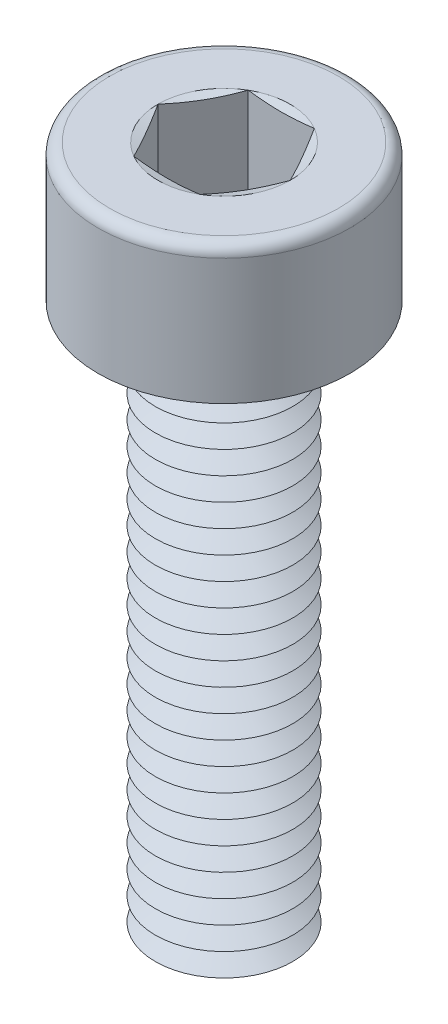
SolidWorks part; units mm, degrees
ref_plane "Front Plane" through (0, 0, 0) normal (0, 0, 1) x (1, 0, 0)
ref_plane "Top Plane" through (0, 0, 0) normal (0, 1, 0) x (1, 0, 0)
ref_plane "Right Plane" through (0, 0, 0) normal (1, 0, 0) x (0, 0, -1)
sketch "Sketch1" plane through (0, 0, 0) normal (0, 1, 0) x (1, 0, 0)
  circle A0 centre (0, 0) radius 1.5
  dimension "D1" = 3
extrude "Extrude1" add sketch "Sketch1" along normal blind 12
sketch "Sketch2" plane through (0, 12, 0) normal (0, 1, 0) x (1, 0, 0)
  circle A0 centre (0, 0) radius 2.75
  dimension "D1" = 5.5
extrude "Extrude2" add sketch "Sketch2" along normal blind 3
sketch "Sketch3" plane through (0, 15, 0) normal (0, 1, 0) x (1, 0, 0)
  line L1 (0.7217, 1.25) -> (-0.7217, 1.25)
  line L2 (-0.7217, 1.25) -> (-1.4434, 0)
  line L3 (-1.4434, 0) -> (-0.7217, -1.25)
  line L4 (-0.7217, -1.25) -> (0.7217, -1.25)
  line L5 (0.7217, -1.25) -> (1.4434, 0)
  line L6 (1.4434, 0) -> (0.7217, 1.25)
  circle A0 centre (0, 0) radius 1.25 construction
  dimension "D1" = 2.5
extrude "Extrude3" cut sketch "Sketch3" against normal blind 2.5
fillet "Fillet1" radius 0.25 1 edges at (0, 15, 2.75)
sketch "Sketch4" plane through (0, 0, 0) normal (1, 0, 0) x (0, 0, -1)
  line L0 (-1.25, 12.5) -> (0, 12.5)
  line L1 (0, 12.5) -> (0, 11.7783)
  line L2 (0, 11.7783) -> (-1.25, 12.5)
  dimension "D1" = 30
revolve "Cut-Revolve1" cut sketch "Sketch4" angle 360 about L1
sketch "Sketch5" plane through (0, 0, 0) normal (0, 0, 1) x (1, 0, 0)
  line L0 (-1.5, 0.25) -> (-1.5, -0.25)
  line L1 (-1.5, 12) -> (-1.5, 0) construction
  line L2 (-1.5, -0.25) -> (-1.067, 0)
  line L3 (-1.5, 0) -> (1.5, 0) construction
  line L4 (-1.067, 0) -> (-1.5, 0.25)
  dimension "D1" = 0.5
revolve "Cut-Revolve2" cut sketch "Sketch5" angle 360 about axis through (0, 12, 0) along (0, -1, 0)
pattern_linear "LPattern1" count 24 spacing 0.5 along (0, 1, 0) of "Cut-Revolve2"
sketch "Sketch6" plane through (0, 15, 0) normal (0, 1, 0) x (1, 0, 0)
  circle A0 centre (0, 0) radius 1.4434
extrude "Extrude4" cut sketch "Sketch6" against normal through all draft 75
